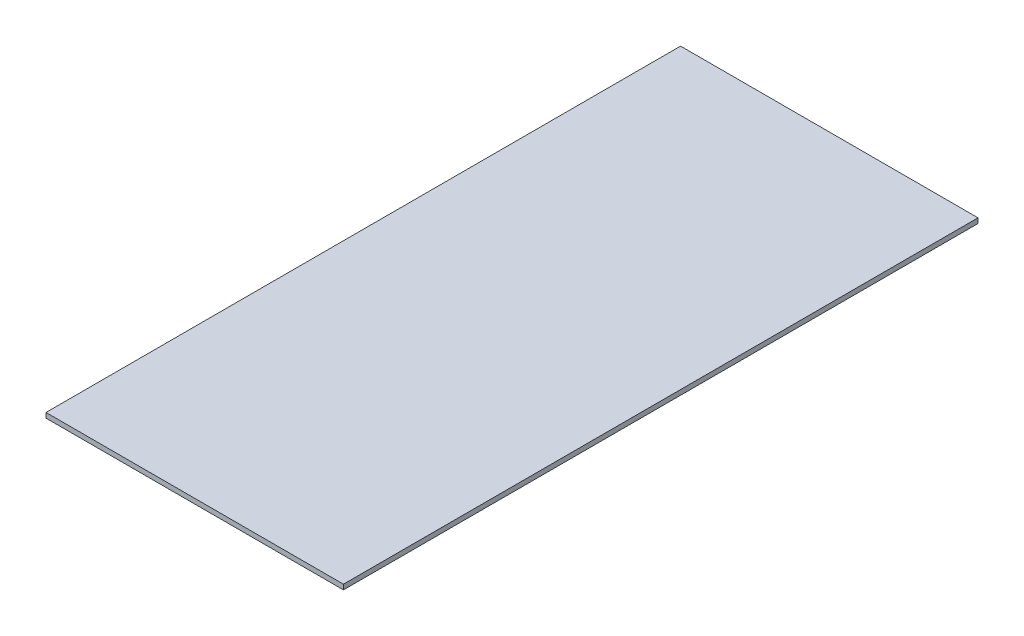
SolidWorks part; units mm, degrees
ref_plane "Front Plane" through (0, 0, 0) normal (0, 0, 1) x (1, 0, 0)
ref_plane "Top Plane" through (0, 0, 0) normal (0, 1, 0) x (1, 0, 0)
ref_plane "Right Plane" through (0, 0, 0) normal (1, 0, 0) x (0, 0, -1)
sketch "Sketch1" plane through (0, 0, 0) normal (0, 1, 0) x (1, 0, 0)
  line L1 (0, 0) -> (60, 0)
  line L2 (0, 0) -> (0, 128)
  line L3 (0, 128) -> (60, 128)
  line L4 (60, 0) -> (60, 128)
  dimension "D1" = 60
  dimension "D2" = 128
extrude "Boss-Extrude1" add sketch "Sketch1" along normal blind 1
